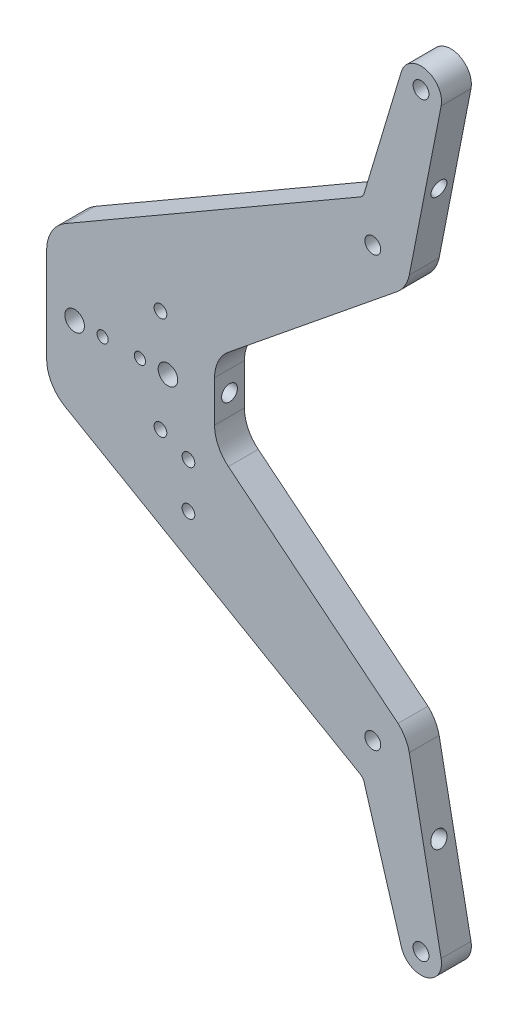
SolidWorks part; units mm, degrees
ref_plane "Plan de face" through (0, 0, 0) normal (0, 0, 1) x (1, 0, 0)
ref_plane "Plan de dessus" through (0, 0, 0) normal (0, 1, 0) x (1, 0, 0)
ref_plane "Plan de droite" through (0, 0, 0) normal (1, 0, 0) x (0, 0, -1)
sketch "Esquisse1" plane through (0, 0, 0) normal (0, 0, 1) x (1, 0, 0)
  line L0 (-319.0323, 200) -> (543.5, 200) construction
  line L1 (0, 508.9563) -> (0, -313.4182) construction
  line L2 (-65.0967, -26.5345) -> (25.8294, -100.2652)
  line L3 (27.6, 203.1593) -> (7.6327, 136.566)
  line L4 (5.5786, 133.9674) -> (-152.5115, 42.5539)
  line L5 (48.9311, 197.884) -> (31.8674, 110.8355)
  line L6 (-72.5, 11) -> (-72.5, -11)
  line L7 (-162.5, 25.24) -> (-162.5, -25.24)
  line L8 (-65.0967, 26.5345) -> (25.8294, 100.2652)
  line L9 (-369.4052, 0) -> (380.5754, 0) construction
  line L10 (48.9311, -197.884) -> (31.8674, -110.8355)
  line L11 (5.5786, -133.9674) -> (-152.5115, -42.5539)
  line L12 (27.6, -203.1593) -> (7.6327, -136.566)
  circle A0 centre (543.5, 0) radius 543.5 construction
  arc A1 (48.9311, 197.884) -> (27.6, 203.1593) centre (38.1365, 200) ccw
  arc A2 (7.6327, 136.566) -> (5.5786, 133.9674) centre (3.33, 137.8561) cw
  arc A3 (-152.5115, 42.5539) -> (-162.5, 25.24) centre (-142.5, 25.24) ccw
  arc A4 (25.8294, 100.2652) -> (31.8674, 110.8355) centre (12.3058, 115) ccw
  arc A5 (-65.0967, 26.5345) -> (-72.5, 11) centre (-52.5, 11) ccw
  arc A6 (-65.0967, -26.5345) -> (-72.5, -11) centre (-52.5, -11) cw
  arc A7 (25.8294, -100.2652) -> (31.8674, -110.8355) centre (12.3058, -115) cw
  arc A8 (-152.5115, -42.5539) -> (-162.5, -25.24) centre (-142.5, -25.24) cw
  arc A9 (7.6327, -136.566) -> (5.5786, -133.9674) centre (3.33, -137.8561) ccw
  arc A10 (48.9311, -197.884) -> (27.6, -203.1593) centre (38.1365, -200) cw
  point P29 (-72.5, 0)
  point P41 (-162.5, 0)
  dimension "D1" = 1087
  dimension "D3" = 90
  dimension "D4" = 115
  dimension "D5" = 20
  dimension "D7" = 20
  dimension "D9" = 11
  dimension "D11" = 4.492
  dimension "D10" = 20
  dimension "D6" = 20
  dimension "D2" = 200
  dimension "D8" = 25.24
  dimension "D12" = 5.6
  dimension "D13" = 165.83
  dimension "D14" = 9
  dimension "D15" = 11
  dimension "D16" = 137.8561
  dimension "D17" = 162.5
extrude "Boss.-Extru.1" add sketch "Esquisse1" along normal blind 16
hole_wizard "Trou taraudé M101" positions "Esquisse4" profile "Esquisse3" tap size "M10" standard "Iso"
sketch "Esquisse4" plane through (0, 0, 16) normal (0, 0, 1) x (1, 0, 0)
  arc A1 (48.9311, 197.884) -> (27.6, 203.1593) centre (38.1365, 200) ccw construction
  arc A2 (25.8294, 100.2652) -> (31.8674, 110.8355) centre (12.3058, 115) ccw construction
  point P5 (38.1365, 200)
  point P13 (12.3058, 115)
sketch "Esquisse3" plane through (38.1365, 200, 16) normal (1, 0, 0) x (0, -1, 0)
  line L0 (0, 0) -> (0, 30.0537)
  line L1 (0, 30.0537) -> (4.25, 27.5)
  line L2 (4.25, 27.5) -> (4.25, 0)
  line L5 (4.25, 0) -> (0, 0)
  line L10 (0, 30.0537) -> (-4.25, 27.5) construction
  line L11 (0, -6.35) -> (0, 107.95) construction
  dimension "Diamètre du trou pour taraudage" = 8.5
  dimension "Profondeur du trou pour taraudage" = 27.5
  dimension "Angle de pointe" = 118
hole_wizard "Trou taraudé M103" positions "Esquisse12" profile "Esquisse11" tap size "M10" standard "Iso"
sketch "Esquisse12" plane through (-30.5669, 9.1651, 0) normal (-0.9579, 0.2872, 0) x (0, 0, 1)
  line L0 (16, 202.5268) -> (16, 133.0045) construction
  line L1 (16, 133.0045) -> (0, 133.0045) construction
  point P0 (8, 156.0045)
  dimension "D1" = 8
  dimension "D2" = 23
sketch "Esquisse11" plane through (14.2385, 158.597, 8) normal (0, 0, 1) x (-0.2872, -0.9579, 0)
  line L0 (0, 0) -> (0, 139.5781)
  line L1 (0, 139.5781) -> (4.25, 139.5781)
  line L2 (4.25, 139.5781) -> (4.25, 0)
  line L5 (4.25, 0) -> (0, 0)
  line L11 (0, -6.35) -> (0, 107.95) construction
  dimension "Diamètre du trou pour taraudage jusqu'au prochain" = 8.5
  dimension "Profondeur du trou pour taraudage jusqu'au prochain" = 139.5781
mirror "Symétrie1" about plane through (0, 0, 0) normal (0, 1, 0) of "Trou taraudé M101", "Trou taraudé M103"
hole_wizard "Diamètre du perçage Ø10.5 (10.5)1" positions "Esquisse6" profile "Esquisse5" hole size "Ø10.5" standard "Iso"
sketch "Esquisse6" plane through (0, 0, 16) normal (0, 0, 1) x (1, 0, 0)
  line L0 (-162.5, 25.24) -> (-162.5, -25.24) construction
  point P0 (-147.5, 0)
  point P2 (-97.5, 0)
  dimension "D1" = 15
  dimension "D2" = 50
sketch "Esquisse5" plane through (-147.5, 0, 16) normal (1, 0, 0) x (0, -1, 0)
  line L0 (0, 0) -> (0, 16)
  line L1 (0, 16) -> (5.25, 16)
  line L2 (5.25, 16) -> (5.25, 0)
  line L5 (5.25, 0) -> (0, 0)
  line L11 (0, -6.35) -> (0, 107.95) construction
  dimension "Diamètre du perçage jusqu'au prochain" = 10.5
  dimension "Profondeur du perçage jusqu'au prochain" = 16
hole_wizard "Trou taraudé M81" positions "Esquisse8" profile "Esquisse7" tap size "M8" standard "Iso"
sketch "Esquisse8" plane through (0, 0, 16) normal (0, 0, 1) x (1, 0, 0)
  line L0 (-162.5, 25.24) -> (-162.5, -25.24) construction
  point P0 (-101.5, 27.5)
  point P2 (-101.5, -27.5)
  point P4 (-86.5, -34)
  point P6 (-86.5, -58)
  dimension "D1" = 61
  dimension "D2" = 55
  dimension "D3" = 76
  dimension "D4" = 24
  dimension "D5" = 34
  dimension "D6" = 27.5
sketch "Esquisse7" plane through (-101.5, 27.5, 16) normal (1, 0, 0) x (0, -1, 0)
  line L0 (0, 0) -> (0, 16)
  line L1 (0, 16) -> (3.4, 16)
  line L2 (3.4, 16) -> (3.4, 0)
  line L5 (3.4, 0) -> (0, 0)
  line L11 (0, -6.35) -> (0, 107.95) construction
  dimension "Diamètre du trou pour taraudage jusqu'au prochain" = 6.8
  dimension "Profondeur du trou pour taraudage jusqu'au prochain" = 16
hole_wizard "Trou taraudé M102" positions "Esquisse10" profile "Esquisse9" tap size "M10" standard "Iso"
sketch "Esquisse10" plane through (-72.5, 0, 0) normal (1, 0, 0) x (0, 0, -1)
  line L0 (-16, 11) -> (0, 11) construction
  point P0 (-8, 0)
  point P6 (-8, 11)
sketch "Esquisse9" plane through (-72.5, 0, 8) normal (0, 1, 0) x (0, 0, -1)
  line L0 (0, 0) -> (0, 19.75)
  line L1 (0, 19.75) -> (4.25, 19.75)
  line L2 (4.25, 19.75) -> (4.25, 0)
  line L5 (4.25, 0) -> (0, 0)
  line L11 (0, -6.35) -> (0, 107.95) construction
  dimension "Diamètre du trou pour taraudage jusqu'au prochain" = 8.5
  dimension "Profondeur du trou pour taraudage jusqu'au prochain" = 19.75
hole_wizard "Diamètre du perçage Ø6.0 (6)1" positions "Esquisse14" profile "Esquisse13" hole size "Ø6.0" standard "Iso"
sketch "Esquisse14" plane through (0, 0, 16) normal (0, 0, 1) x (1, 0, 0)
  line L0 (-162.5, 25.24) -> (-162.5, -25.24) construction
  point P0 (-132.5, 0)
  point P2 (-112.5, 0)
  dimension "D1" = 20
  dimension "D2" = 30
sketch "Esquisse13" plane through (-132.5, 0, 16) normal (1, 0, 0) x (0, -1, 0)
  line L0 (0, 0) -> (0, 7.8026)
  line L1 (0, 7.8026) -> (3, 6)
  line L2 (3, 6) -> (3, 0)
  line L5 (3, 0) -> (0, 0)
  line L10 (0, 7.8026) -> (-3, 6) construction
  line L11 (0, -6.35) -> (0, 107.95) construction
  dimension "Diamètre du perçage" = 6
  dimension "Profondeur du perçage" = 6
  dimension "Angle de pointe" = 118
